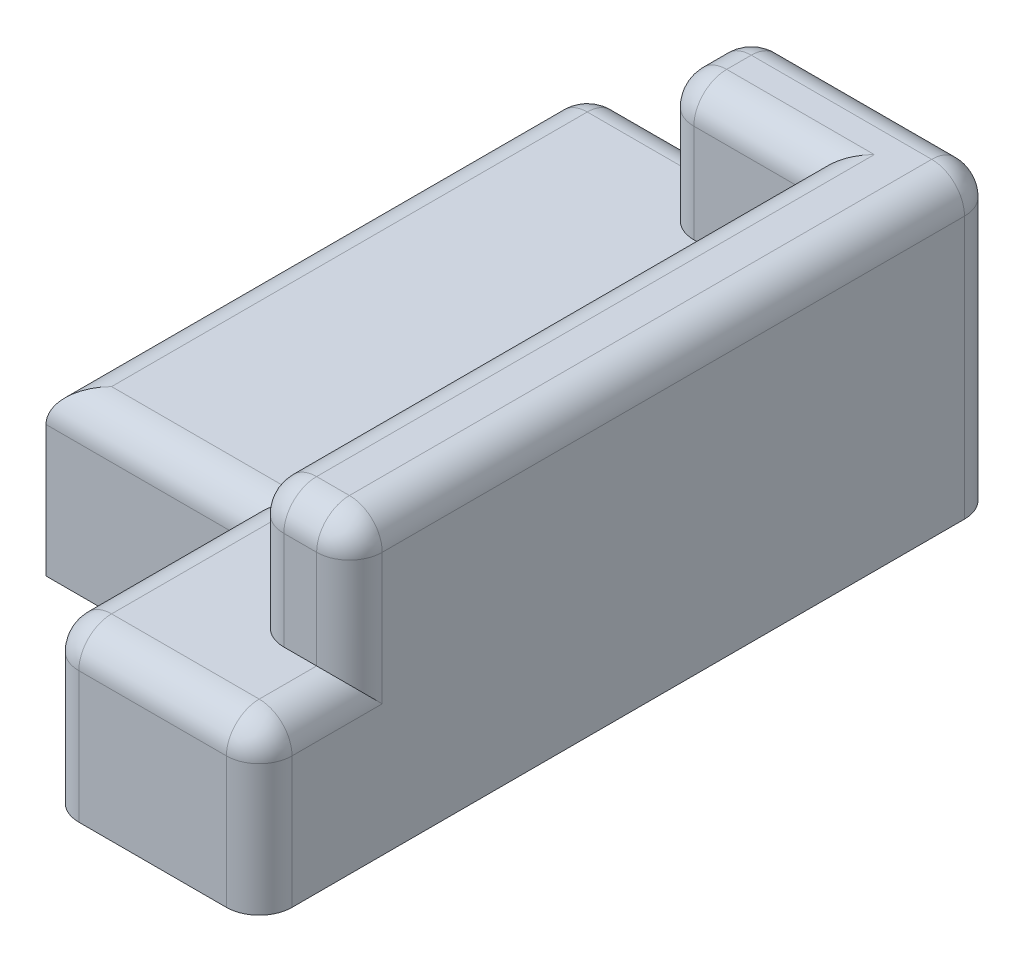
SolidWorks part; units mm, degrees
ref_plane "Plano frontal" through (0, 0, 0) normal (0, 0, 1) x (1, 0, 0)
ref_plane "Plano superior" through (0, 0, 0) normal (0, 1, 0) x (1, 0, 0)
ref_plane "Plano direito" through (0, 0, 0) normal (1, 0, 0) x (0, 0, -1)
sketch "Esboço1" plane through (0, 0, 0) normal (0, 1, 0) x (1, 0, 0)
  line L1 (0, 0) -> (25, 0)
  line L2 (0, 0) -> (0, 45)
  line L3 (0, 45) -> (25, 45)
  line L4 (25, 0) -> (25, 45)
  dimension "D1" = 25
  dimension "D2" = 45
extrude "Ressalto-extrusão1" add sketch "Esboço1" along normal blind 10 contours L3 L4 L1 L2
sketch "Esboço2" plane through (0, 10, 0) normal (0, 1, 0) x (1, 0, 0)
  line L0 (0, 5.5) -> (0, 39.5) construction
  line L1 (0, 0) -> (0, 45) construction
  line L2 (0, 39.5) -> (19, 39.5)
  line L3 (25, 0) -> (25, 45) construction
  line L4 (25, 39.5) -> (25, 45)
  line L5 (25, 45) -> (0, 45)
  line L6 (0, 45) -> (0, 39.5)
  line L7 (0, 5.5) -> (0, 0)
  line L8 (0, 0) -> (25, 0)
  line L10 (19, 5.5) -> (0, 5.5)
  line L11 (19, 39.5) -> (19, 5.5)
  line L12 (25, 39.5) -> (25, 0)
  point P5 (0, 22.5)
  dimension "D1" = 34
  dimension "D2" = 5.5
  dimension "D3" = 5.5
  dimension "D4" = 6
extrude "Ressalto-extrusão2" add sketch "Esboço2" along normal blind 28
sketch "Esboço3" plane through (0, 38, 0) normal (0, 1, 0) x (1, 0, 0)
  line L1 (25, 45) -> (0, 45)
  line L2 (25, 45) -> (25, 0)
  line L3 (25, 0) -> (0, 0)
  line L4 (0, 45) -> (0, 0)
extrude "Ressalto-extrusão3" add sketch "Esboço3" along normal blind 6
sketch "Esboço4" plane through (0, 0, 0) normal (0, -1, 0) x (1, 0, 0)
  line L0 (0, -3) -> (25, -3) construction
  line L1 (0, 0) -> (0, -45) construction
  line L2 (25, 0) -> (25, -45) construction
  line L3 (0, -42) -> (25, -42) construction
  line L4 (0, -45) -> (25, -45) construction
  line L5 (0, 0) -> (25, 0) construction
  point P12 (5, -3)
  point P13 (20, -3)
  point P14 (5, -42)
  point P15 (20, -42)
  dimension "D1" = 3
  dimension "D2" = 3
  dimension "D3" = 5
  dimension "D4" = 5
  dimension "D5" = 5
  dimension "D6" = 5
hole_wizard "Furo de diâmetro Ø4.0 (4)1" positions "3DSketch1" profile "Esboço5" hole size "Ø4.0" standard "ISO"
sketch3d "3DSketch1"
  point P3 (20, 0, -3)
  point P6 (20, 0, -42)
  point P9 (5, 0, -42)
sketch "Esboço5" plane through (20, 0, -3) normal (1, 0, 0) x (0, 0, -1)
  line L0 (0, 0) -> (0, 6.2017)
  line L1 (0, 6.2017) -> (2, 5)
  line L2 (2, 5) -> (2, 0)
  line L5 (2, 0) -> (0, 0)
  line L10 (0, 6.2017) -> (-2, 5) construction
  line L11 (0, -6.35) -> (0, 107.95) construction
  dimension "Hole Dia." = 4
  dimension "Hole Depth" = 5
  dimension "Drill Angle" = 118
sketch "Esboço7" plane through (0, 0, -45) normal (0, 0, -1) x (-1, 0, 0)
  line L0 (0, 10) -> (-10, 10)
  line L1 (-10, 10) -> (-10, 38)
  line L2 (-10, 38) -> (0, 38)
  line L3 (0, 44) -> (0, 0) construction
  line L4 (0, 38) -> (0, 10)
  line L5 (0, 38) -> (-19, 38) construction
  dimension "D1" = 10
extrude "Corte-extrusão2" cut sketch "Esboço7" against normal up to surface (5.5 mm away)
sketch "Esboço8" plane through (0, 0, 0) normal (-1, 0, 0) x (0, 0, 1)
  line L1 (0, 0) -> (-12, 0)
  line L2 (0, 0) -> (0, 12)
  line L3 (0, 12) -> (-12, 12)
  line L4 (-12, 0) -> (-12, 12)
  dimension "D1" = 12
  dimension "D2" = 12
extrude "Corte-extrusão3" cut sketch "Esboço8" against normal blind 12
sketch "Esboço9" plane through (0, 0, 0) normal (-1, 0, 0) x (0, 0, 1)
  line L0 (-45, 44) -> (-45, 18)
  line L1 (-45, 38) -> (-45, 10) construction
  line L2 (-45, 18) -> (-5.5, 18)
  line L3 (-5.5, 38) -> (-5.5, 10) construction
  line L4 (-5.5, 18) -> (-5.5, 10)
  line L5 (-5.5, 10) -> (0, 10)
  line L6 (0, 0) -> (0, 12) construction
  line L7 (0, 10) -> (0, 44)
  line L8 (0, 44) -> (-45, 44)
  dimension "D1" = 8
extrude "Corte-extrusão4" cut sketch "Esboço9" against normal through all
fillet "Filete2" radius 2 20 edges at (19, 18, -22.5) (14.5, 18, -39.5) (10, 18, -42.25) (17.5, 18, -45) (25, 18, -25.25) (22, 18, -5.5) (25, 9, -45) (25, 14, -5.5) (25, 10, -2.75) (25, 5, 0) (12, 10, -6) (18.5, 10, 0) (12, 5, 0) (6, 10, -12) (19, 14, -5.5) (10, 14, -39.5) (0, 5, -45) (0, 10, -28.5) (5, 10, -45) (10, 14, -45)
